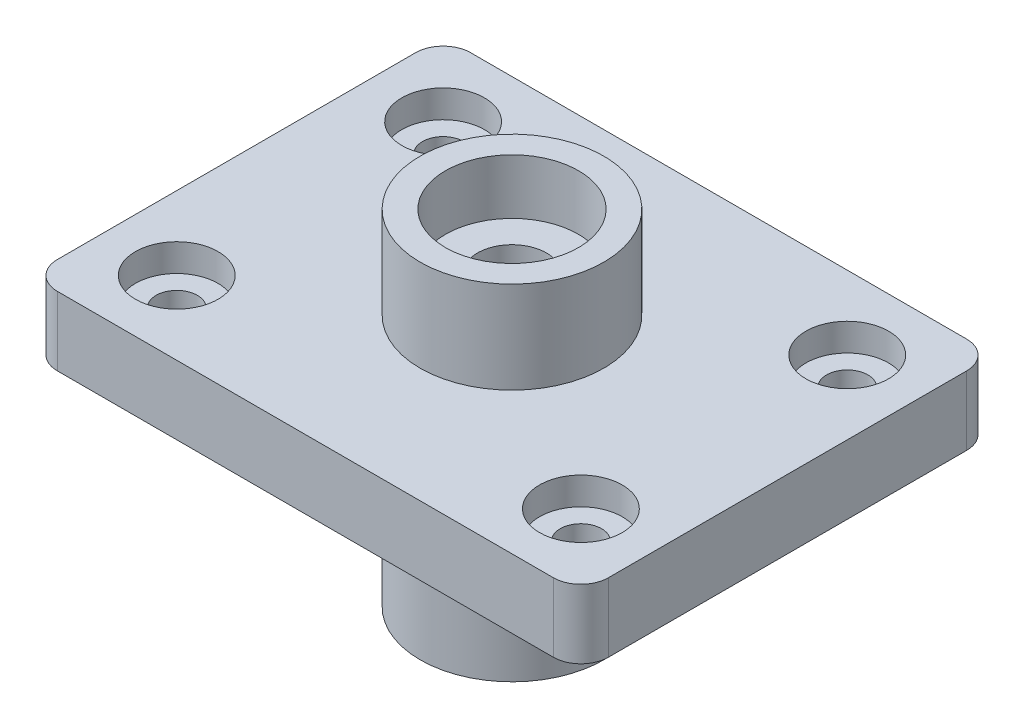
SolidWorks part; units mm, degrees
ref_plane "Front Plane" through (0, 0, 0) normal (0, 0, 1) x (1, 0, 0)
ref_plane "Top Plane" through (0, 0, 0) normal (0, 1, 0) x (1, 0, 0)
ref_plane "Right Plane" through (0, 0, 0) normal (1, 0, 0) x (0, 0, -1)
sketch "Sketch1" plane through (0, 0, 0) normal (0, 1, 0) x (1, 0, 0)
  line L1 (-120, 90) -> (120, 90)
  line L2 (-120, 90) -> (-120, -90)
  line L3 (-120, -90) -> (120, -90)
  line L4 (120, 90) -> (120, -90)
  dimension "D1" = 120
  dimension "D2" = 240
  dimension "D3" = 180
  dimension "D4" = 90
extrude "Extrude1" add sketch "Sketch1" against normal blind 30
ref_plane "Plane1" through (0, 40, 0) normal (0, 1, 0) x (-1, 0, 0)
sketch "Sketch2" plane through (0, 40, 0) normal (0, 1, 0) x (-1, 0, 0)
  circle A0 centre (0, 0) radius 40
  dimension "D1" = 80
extrude "Extrude2" add sketch "Sketch2" against normal blind 150
hole_wizard "CBORE for M5 Hex Head Bolt2" positions "3DSketch3" profile "Sketch7" counterbore size "M5" standard "Ansi Metric"
sketch3d "3DSketch3"
  circle A0 centre (0, 40, 0) radius 40 construction
  point P0 (0, 40, 0)
  point P5 (0, 80, 0)
sketch "Sketch7" plane through (0, 40, 0) normal (1, 0, 0) x (0, 0, 1)
  line L0 (0, 0) -> (0, 150)
  line L1 (0, 150) -> (15, 150)
  line L3 (15, 150) -> (15, 24)
  line L4 (15, 24) -> (29, 24)
  line L5 (29, 24) -> (29, 0)
  line L7 (29, 0) -> (0, 0)
  line L11 (0, -6.35) -> (0, 107.95) construction
  dimension "Thru Hole Dia." = 30
  dimension "Thru Hole Depth" = 150
  dimension "C'Bore Dia." = 58
  dimension "C'Bore Depth" = 24
ref_plane "Plane2" through (0, -98, 0) normal (0, 1, 0) x (-1, 0, 0)
sketch "Sketch8" plane through (0, -98, 0) normal (0, 1, 0) x (-1, 0, 0)
  circle A0 centre (0, 0) radius 23
  circle A1 centre (0, 0) radius 40 construction
  dimension "D1" = 46
extrude "Cut-Extrude1" cut sketch "Sketch8" along normal blind 12
hole_wizard "CBORE for M5 Hex Head Bolt3" positions "3DSketch5" profile "Sketch10" counterbore size "M5" standard "Ansi Metric"
sketch3d "3DSketch5"
  point P1 (-88, 0, -58)
sketch "Sketch10" plane through (-88, 0, -58) normal (1, 0, 0) x (0, 0, 1)
  line L0 (0, 0) -> (0, 30.001)
  line L1 (0, 30.001) -> (9, 30.001)
  line L3 (9, 30.001) -> (9, 12)
  line L4 (9, 12) -> (18, 12)
  line L5 (18, 12) -> (18, 0)
  line L7 (18, 0) -> (0, 0)
  line L11 (0, -6.35) -> (0, 107.95) construction
  dimension "Thru Hole Dia." = 18
  dimension "Thru Hole Depth" = 30.001
  dimension "C'Bore Dia." = 36
  dimension "C'Bore Depth" = 12
pattern_linear "LPattern1" count 2 spacing 116 along (0, 0, 1) count 2 spacing 176 along (1, 0, 0) of "CBORE for M5 Hex Head Bolt3"
fillet "Fillet1" radius 12 4 edges at (120, -15, -90) (120, -15, 90) (-120, -15, 90) (-120, -15, -90)
